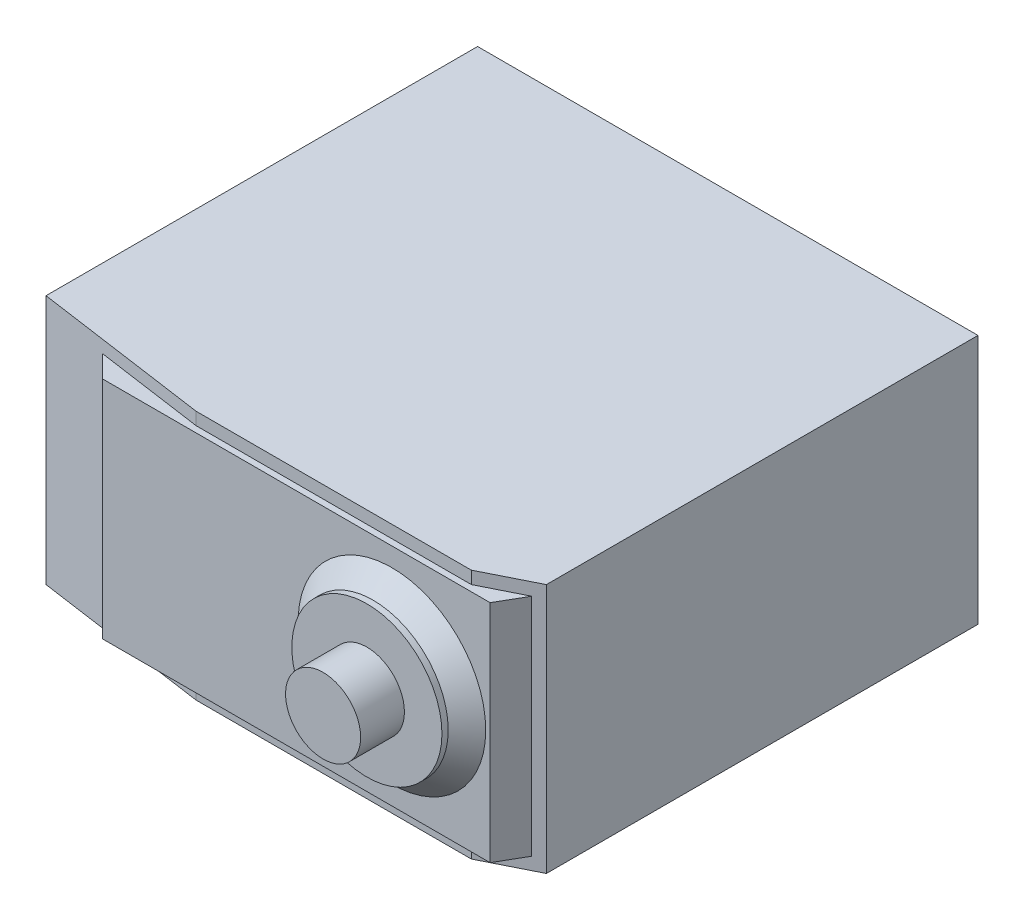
SolidWorks part; units mm, degrees
ref_plane "Plan de face" through (0, 0, 0) normal (0, 0, 1) x (1, 0, 0)
ref_plane "Plan de dessus" through (0, 0, 0) normal (0, 1, 0) x (1, 0, 0)
ref_plane "Plan de droite" through (0, 0, 0) normal (1, 0, 0) x (0, 0, -1)
sketch "Esquisse1" plane through (0, 0, 0) normal (0, 0, 1) x (1, 0, 0)
  line L1 (20, -10) -> (-20, -10)
  line L2 (20, -10) -> (20, 10)
  line L3 (20, 10) -> (-20, 10)
  line L4 (-20, -10) -> (-20, 10)
  line L5 (20, -10) -> (-20, 10) construction
  line L6 (20, 10) -> (-20, -10) construction
  point P0 (0, 0)
  dimension "D1" = 40
  dimension "D2" = 20
extrude "Boss.-Extru.1" add sketch "Esquisse1" along normal blind 36.5
sketch "Esquisse2" plane through (0, -10, 0) normal (0, -1, 0) x (1, 0, 0)
  line L0 (-20, 36.5) -> (-6, 36.5)
  line L1 (-20, 36.5) -> (20, 36.5) construction
  line L2 (-6, 36.5) -> (-20, 34.5)
  line L3 (-20, 36.5) -> (-20, 0) construction
  line L4 (-20, 34.5) -> (-20, 36.5)
  line L5 (16, 36.5) -> (20, 36.5)
  line L6 (20, 36.5) -> (20, 34.5)
  line L7 (20, 36.5) -> (20, 0) construction
  line L8 (20, 34.5) -> (16, 36.5)
  dimension "D1" = 2
  dimension "D2" = 14
  dimension "D3" = 4
  dimension "D4" = 2
extrude "Enlèv. mat.-Extru.1" cut sketch "Esquisse2" against normal through all
ref_plane "Plan1" through (0, 0, 37) normal (0, 0, 1) x (1, 0, 0)
sketch "Esquisse3" plane through (0, 0, 37) normal (0, 0, 1) x (1, 0, 0)
  line L0 (-20, 10) -> (-20, -10) construction
  line L1 (-13, 9) -> (18, 9)
  line L2 (-13, 9) -> (-13, -9)
  line L3 (-13, -9) -> (18, -9)
  line L4 (18, 9) -> (18, -9)
  line L5 (16, 10) -> (-6, 10) construction
  dimension "D1" = 31
  dimension "D2" = 7
  dimension "D3" = 18
  dimension "D4" = 1
extrude "Boss.-Extru.2" add sketch "Esquisse3" against normal blind 5
sketch "Esquisse4" plane through (0, -9, 0) normal (0, -1, 0) x (1, 0, 0)
  line L0 (-13, 37) -> (-16.9712, 33.0288)
  line L1 (-16.9712, 33.0288) -> (-13, 33.0288)
  line L2 (-13, 33.0288) -> (-13, 37)
  line L3 (18, 37) -> (19.546, 34.3223)
  line L4 (19.546, 34.3223) -> (18, 34.3223)
  line L5 (18, 34.3223) -> (18, 37)
  dimension "D1" = 45
  dimension "D2" = 30
extrude "Boss.-Extru.3" add sketch "Esquisse4" against normal blind 18
sketch "Esquisse5" plane through (0, 0, 37) normal (0, 0, 1) x (1, 0, 0)
  line L0 (-20, 10) -> (-20, -10) construction
  line L1 (16, 10) -> (-6, 10) construction
  circle A0 centre (10.15, 0) radius 6
  dimension "D1" = 12
  dimension "D2" = 30.15
  dimension "D3" = 10
extrude "Boss.-Extru.4" add sketch "Esquisse5" along normal blind 2
chamfer "Chanfrein1" distance 1.5 angle 45 1 edges at (16.15, 0, 37)
sketch "Esquisse6" plane through (0, 0, 39) normal (0, 0, 1) x (1, 0, 0)
  circle A0 centre (10.15, 0) radius 3
  dimension "D1" = 6
extrude "Boss.-Extru.5" add sketch "Esquisse6" along normal blind 3.5
